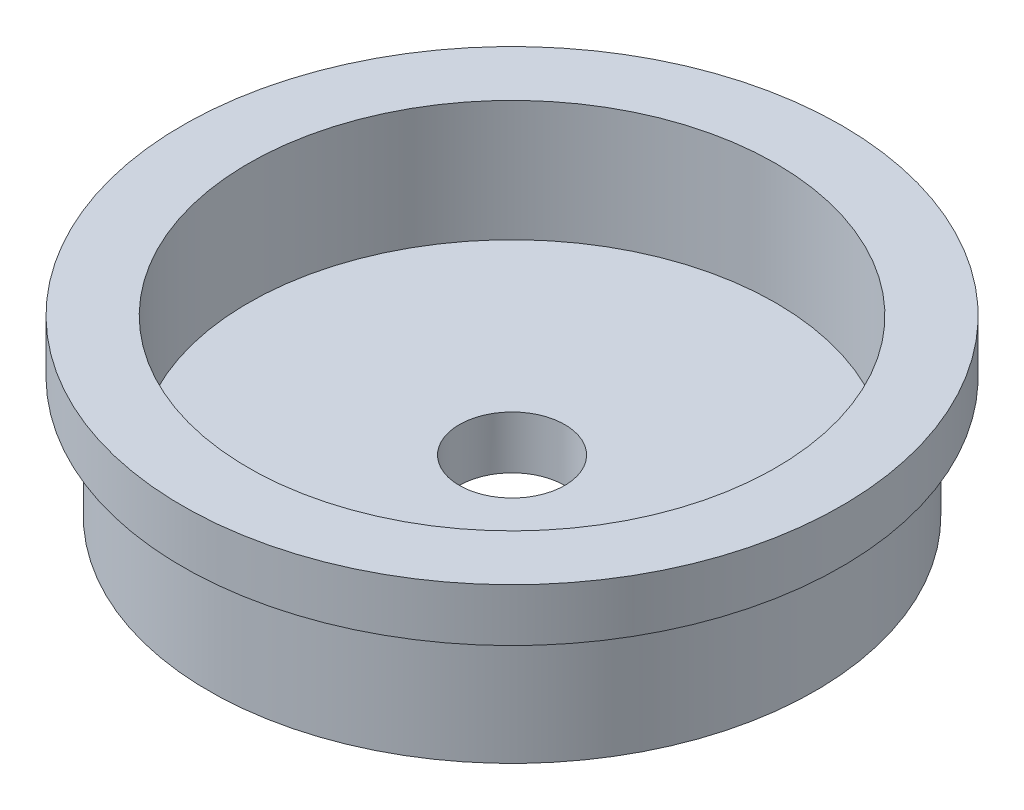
SolidWorks part; units mm, degrees
ref_plane "Plan de face" through (0, 0, 0) normal (0, 0, 1) x (1, 0, 0)
ref_plane "Plan de dessus" through (0, 0, 0) normal (0, 1, 0) x (1, 0, 0)
ref_plane "Plan de droite" through (0, 0, 0) normal (1, 0, 0) x (0, 0, -1)
sketch "Esquisse1" plane through (0, 0, 0) normal (0, 0, 1) x (1, 0, 0)
  line L0 (0, 0) -> (0, 10.6627) construction
  line L1 (0, 0) -> (5.75, 0)
  line L2 (5.75, 0) -> (5.75, 2)
  line L3 (0, 0) -> (0, 1)
  line L4 (6.25, 2.289) -> (6.25, 3.289)
  line L5 (6.25, 3.289) -> (5, 3.289)
  line L6 (5, 3.289) -> (5, 1)
  line L7 (5, 1) -> (0, 1)
  line L8 (6.25, 2.289) -> (5.75, 2)
  point P5 (5.9, 1.412)
  point P10 (6.25, 2.2286)
  point P12 (5.9, 1.7036)
  point P13 (6.25, 2.289)
  dimension "D1" = 11.5
  dimension "D2" = 1
  dimension "D3" = 10
  dimension "D4" = 2
  dimension "D5" = 1
  dimension "D6" = 12.5
revolve "Révolution1" add sketch "Esquisse1" angle 360 about L0
sketch "Esquisse2" plane through (0, 1, 0) normal (0, 1, 0) x (1, 0, 0)
  circle A0 centre (0, 0) radius 1
  dimension "D1" = 2
extrude "Enlèv. mat.-Extru.1" cut sketch "Esquisse2" against normal blind 10
